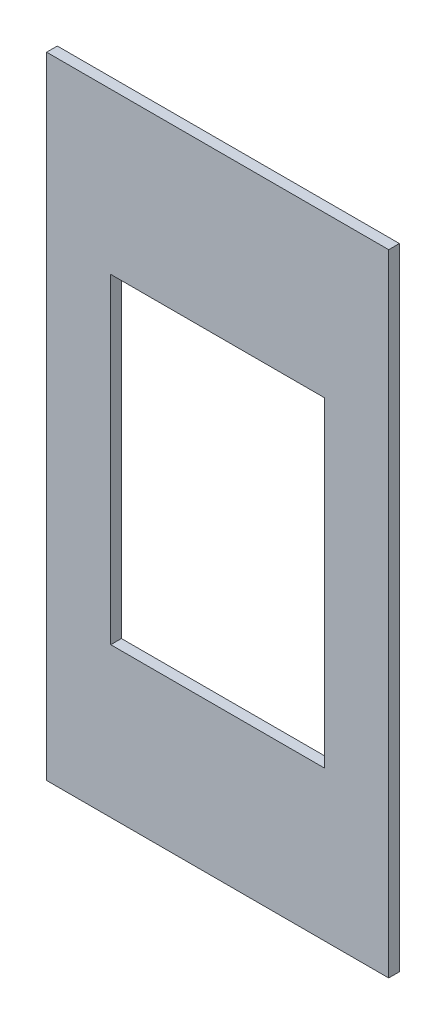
SolidWorks part; units mm, degrees
ref_plane "Front" through (0, 0, 0) normal (0, 0, 1) x (1, 0, 0)
ref_plane "Top" through (0, 0, 0) normal (0, 1, 0) x (1, 0, 0)
ref_plane "Right" through (0, 0, 0) normal (1, 0, 0) x (0, 0, -1)
sketch "Sketch1" plane through (0, 0, 0) normal (0, 0, 1) x (1, 0, 0)
  line L0 (-203.2, 374.65) -> (203.2, -374.65) construction
  line L1 (-203.2, 374.65) -> (203.2, 374.65)
  line L2 (-203.2, 374.65) -> (-203.2, -374.65)
  line L3 (-203.2, -374.65) -> (203.2, -374.65)
  line L4 (203.2, 374.65) -> (203.2, -374.65)
  line L6 (-127, 184.15) -> (127, 184.15)
  line L7 (-127, 184.15) -> (-127, -196.85)
  line L8 (-127, -196.85) -> (127, -196.85)
  line L9 (127, 184.15) -> (127, -196.85)
  point P4 (0, 0)
  dimension "D1" = 190.5
  dimension "D2" = 406.4
  dimension "D3" = 177.8
  dimension "D4" = 749.3
extrude "Extrude1" add sketch "Sketch1" along normal blind 12.7
